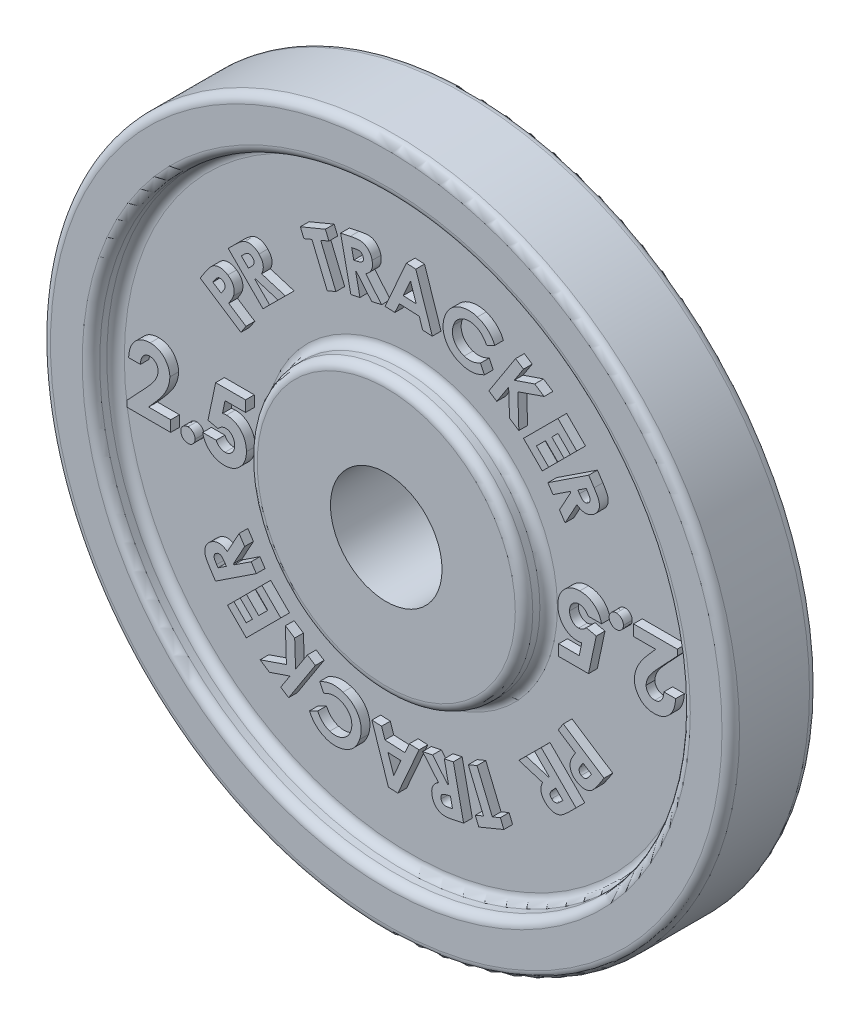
SolidWorks part; units mm, degrees
ref_plane "Plano frontal" through (0, 0, 0) normal (0, 0, 1) x (1, 0, 0)
ref_plane "Plano superior" through (0, 0, 0) normal (0, 1, 0) x (1, 0, 0)
ref_plane "Plano direito" through (0, 0, 0) normal (1, 0, 0) x (0, 0, -1)
sketch "Esboço1" plane through (0, 0, 0) normal (0, 0, 1) x (1, 0, 0)
  circle A0 centre (0, 0) radius 15.75
  circle A1 centre (0, 0) radius 2.55
  dimension "D1" = 31.5
  dimension "D2" = 5.1
extrude "Ressalto-extrusão1" add sketch "Esboço1" along normal blind 4
sketch "Esboço2" plane through (0, 0, 4) normal (0, 0, 1) x (1, 0, 0)
  circle A0 centre (0, 0) radius 13.5
  circle A1 centre (0, 0) radius 15.75
  circle A2 centre (0, 0) radius 15.75
  circle A5 centre (0, 0) radius 6.3
  circle A6 centre (0, 0) radius 6.3
  dimension "D1" = 0
  dimension "D2" = 2.25
  dimension "D3" = 3.75
extrude "Corte-extrusão1" cut sketch "Esboço2" against normal blind 1.125 contours A0 A6
fillet "Filete1" radius 0.4 4 edges at (6.3, 0, 2.875) (13.5, 0, 2.875) (6.3, 0, 4) (13.5, 0, 4)
sketch "Esboço3" plane through (0, 0, 2.875) normal (0, 0, 1) x (1, 0, 0)
  arc A0 (8.4375, 0) -> (-8.4375, 0) centre (0, 0) ccw construction
  text T0 "<b>PR  TRACKER</b>" font "Century Gothic" height 2.25
  dimension "D1" = 16.875
extrude "Ressalto-extrusão2" add sketch "Esboço3" along normal blind 0.4
sketch "Esboço5" plane through (0, 0, 2.875) normal (0, 0, 1) x (1, 0, 0)
  line L0 (-13.0138, -1.5) -> (-6.5299, -1.5) construction
  line L1 (0, 0) -> (-13.1, 0) construction
  circle A2 centre (0, 0) radius 13.1 construction
  circle A3 centre (0, 0) radius 6.7 construction
  text T0 "<b>2.5</b>" font "Century Gothic" height 3
  dimension "D1" = 1.5
extrude "Ressalto-extrusão3" add sketch "Esboço5" along normal blind 0.4
pattern_circular "PadrãoCircular1" count 2 over 360 about axis through (0, 0, 4) along (0, 0, 1) of "Ressalto-extrusão2", "Ressalto-extrusão3"
ref_plane "Plano1" through (0, 0, 2) normal (0, 0, 1) x (1, 0, 0)
fillet "Filete2" radius 0.4 2 edges at (15.75, 0, 0) (15.75, 0, 4)
mirror "Espelhar6" about plane through (0, 0, 2) normal (0, 0, 1) of "Corte-extrusão1"
fillet "Filete3" radius 0.4 4 edges at (13.5, 0, 1.125) (6.3, 0, 0) (13.5, 0, 0) (6.3, 0, 1.125)
sketch "Esboço10" plane through (0, 0, 1.125) normal (0, 0, -1) x (-1, 0, 0)
  line L0 (-8.4375, 0) -> (8.4375, 0) construction
  arc A0 (8.4375, 0) -> (-8.4375, 0) centre (0, 0) ccw construction
  text T0 "<b>PR  TRACKER</b>" font "Century Gothic" height 2.25
  dimension "D1" = 16.875
extrude "Ressalto-extrusão4" add sketch "Esboço10" along normal blind 0.4
sketch "Esboço12" plane through (0, 0, 1.125) normal (0, 0, -1) x (-1, 0, 0)
  line L0 (-13.0138, -1.5) -> (-6.1188, -1.5) construction
  circle A0 centre (0, 0) radius 13.1 construction
  circle A1 centre (0, 0) radius 6.3 construction
  text T0 "<b>2.5</b>  " font "Century Gothic" height 3
  dimension "D1" = 1.5
extrude "Ressalto-extrusão5" add sketch "Esboço12" along normal blind 0.4
pattern_circular "PadrãoCircular2" count 2 over 360 about axis through (0, 0, 0) along (0, 0, 1) of "Ressalto-extrusão4", "Ressalto-extrusão5"
sketch "Esboço13" plane through (0, 0, 2.875) normal (0, 0, 1) x (1, 0, 0)
  line L0 (-7.1565, 1.5) -> (9.5953, 1.5) construction
